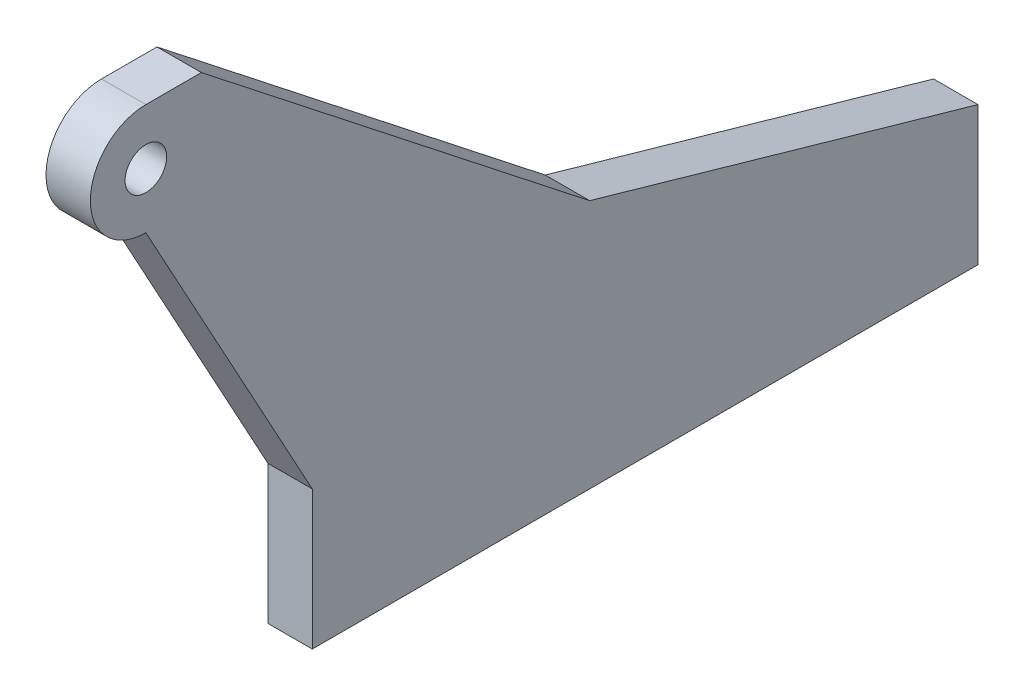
SolidWorks part; units mm, degrees
ref_plane "Спереди" through (0, 0, 0) normal (0, 0, 1) x (1, 0, 0)
ref_plane "Сверху" through (0, 0, 0) normal (0, 1, 0) x (1, 0, 0)
ref_plane "Справа" through (0, 0, 0) normal (1, 0, 0) x (0, 0, -1)
sketch "Эскиз1" plane through (0, 0, 0) normal (1, 0, 0) x (0, 0, -1)
  line L0 (0, 0) -> (24, 0)
  line L1 (24, 0) -> (24, 5)
  line L2 (24, 5) -> (10, 9)
  line L3 (10, 9) -> (-4, 20)
  line L4 (-4, 20) -> (-6, 20)
  line L5 (0, 0) -> (0, 5)
  line L6 (0, 5) -> (-6, 16)
  line L7 (-6, 20) -> (-6, 16) construction
  line L8 (0, 5) -> (24, 5) construction
  arc A0 (-6, 20) -> (-6, 16) centre (-6, 18) ccw
  circle A1 centre (-6, 18) radius 0.75
  dimension "D7" = 1.5
  dimension "D8" = 2
  dimension "D1" = 24
  dimension "D2" = 5
  dimension "D3" = 10
  dimension "D4" = 9
  dimension "D5" = 16
  dimension "D6" = 2
  dimension "D9" = 6
extrude "Бобышка-Вытянуть1" add sketch "Эскиз1" along normal blind 1.6
